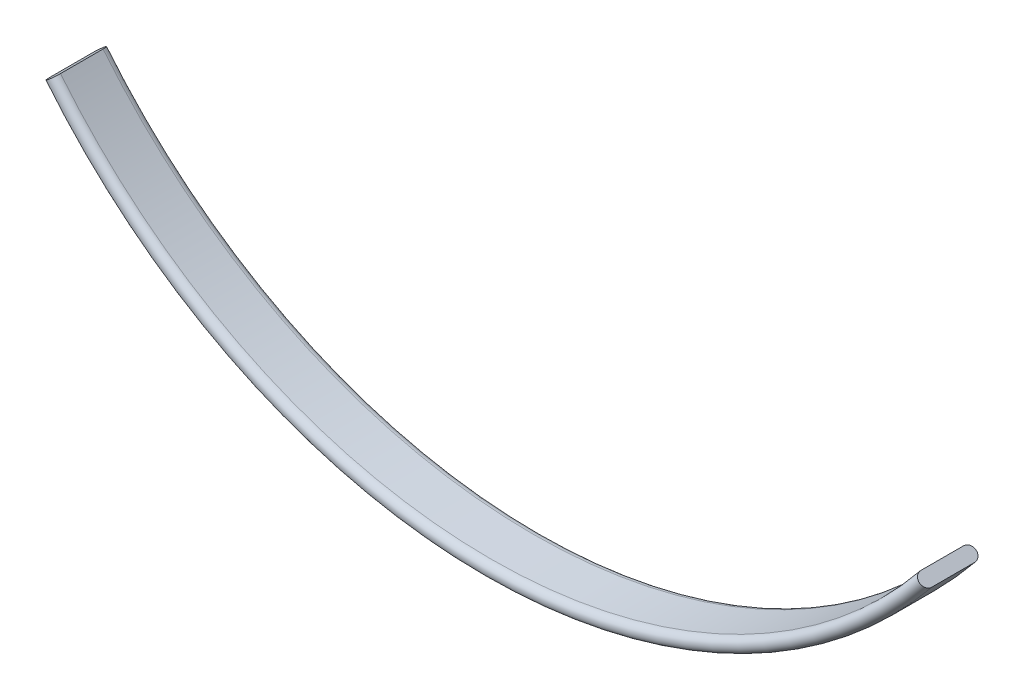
SolidWorks part; units mm, degrees
ref_plane "Plan de face" through (0, 0, 0) normal (0, 0, 1) x (1, 0, 0)
ref_plane "Plan de dessus" through (0, 0, 0) normal (0, 1, 0) x (1, 0, 0)
ref_plane "Plan de droite" through (0, 0, 0) normal (1, 0, 0) x (0, 0, -1)
ref_plane "Plan1" through (-44.2612, 54.658, 0) normal (-0.6293, 0.7771, 0) x (-0.7771, -0.6293, 0)
sketch "Esquisse1" plane through (-44.2612, 54.658, 0) normal (-0.6293, 0.7771, 0) x (-0.7771, -0.6293, 0)
  line L0 (103.0465, 2) -> (103.0465, 14)
  line L1 (99.0465, 14) -> (99.0465, 2)
  line L2 (-56.9535, 16.1127) -> (-56.9535, -0.1127) construction
  arc A0 (103.0465, 2) -> (99.0465, 2) centre (101.0465, 2) cw
  arc A1 (99.0465, 14) -> (103.0465, 14) centre (101.0465, 14) cw
revolve "Révolution1" add sketch "Esquisse1" angle 102 about L2
